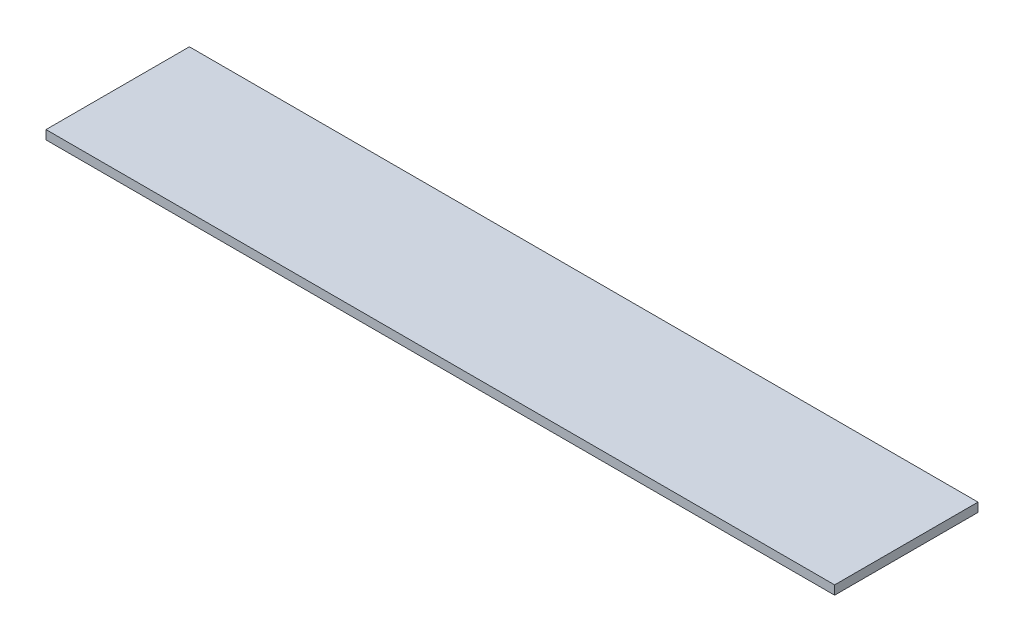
SolidWorks part; units mm, degrees
ref_plane "FRONT" through (0, 0, 0) normal (0, 0, 1) x (1, 0, 0)
ref_plane "TOP" through (0, 0, 0) normal (0, 1, 0) x (1, 0, 0)
ref_plane "RIGHT" through (0, 0, 0) normal (1, 0, 0) x (0, 0, -1)
sketch "Sketch1" plane through (0, 0, 0) normal (0, 1, 0) x (1, 0, 0)
  line L1 (-279.4, 50.8) -> (279.4, 50.8)
  line L2 (-279.4, 50.8) -> (-279.4, -50.8)
  line L3 (-279.4, -50.8) -> (279.4, -50.8)
  line L4 (279.4, 50.8) -> (279.4, -50.8)
  line L5 (-279.4, 50.8) -> (279.4, -50.8) construction
  line L6 (-279.4, -50.8) -> (279.4, 50.8) construction
  point P0 (0, 0)
  dimension "D1" = 101.6
  dimension "D2" = 558.8
extrude "Boss-Extrude1" add sketch "Sketch1" along normal blind 6.35
